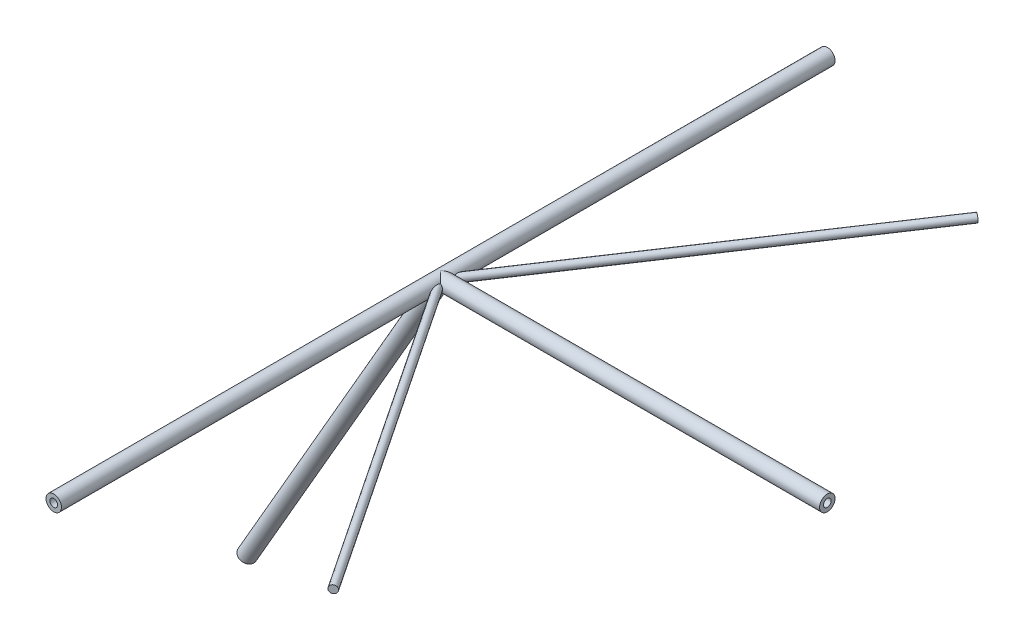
SolidWorks part; units mm, degrees
ref_plane "Front Plane" through (0, 0, 0) normal (0, 0, 1) x (1, 0, 0)
ref_plane "Top Plane" through (0, 0, 0) normal (0, 1, 0) x (1, 0, 0)
ref_plane "Right Plane" through (0, 0, 0) normal (1, 0, 0) x (0, 0, -1)
sketch "Sketch3" plane through (0, 0, 0) normal (0, 1, 0) x (1, 0, 0)
  line L0 (0, 0) -> (500, 0)
  dimension "D1" = 500
sketch "Sketch5" plane through (0, 0, 0) normal (0, 0, 1) x (1, 0, 0)
  line L0 (0, 0) -> (-250, -433.0127)
  line L1 (0, 0) -> (500, 0) construction
  dimension "D1" = 120
  dimension "D2" = 500
sketch "Sketch6" plane through (0, 0, 0) normal (1, 0, 0) x (0, 0, -1)
  line L0 (500, 0) -> (-500, 0)
  dimension "D1" = 1000
ref_plane "Plane1" through (0, 0, 500) normal (0, 0, 1) x (1, 0, 0)
ref_plane "Plane2" through (500, 0, 0) normal (1, 0, 0) x (0, 0, -1)
ref_plane "Plane3" through (0, 0, 0) normal (-0.866, 0.5, 0) x (0, 0, 1)
ref_plane "Plane4" through (-250, -433.0127, 0) normal (-0.5, -0.866, 0) x (-0.866, 0.5, 0)
sketch "Sketch7" plane through (0, 0, 500) normal (0, 0, 1) x (1, 0, 0)
  circle A0 centre (0, 0) radius 10
  dimension "D1" = 20
sketch "Sketch8" plane through (500, 0, 0) normal (1, 0, 0) x (0, 0, -1)
  circle A0 centre (0, 0) radius 10
  dimension "D1" = 20
sketch "Sketch9" plane through (-250, -433.0127, 0) normal (-0.5, -0.866, 0) x (-0.866, 0.5, 0)
  circle A0 centre (0, 0) radius 10
  dimension "D1" = 20
sweep "Sweep1" add profiles "Sketch7" path "Sketch6"
sweep "Sweep2" add profiles "Sketch9" path "Sketch5"
sweep "Sweep3" add profiles "Sketch8" path "Sketch3"
sketch "Sketch10" plane through (0, 0, 0) normal (0, 1, 0) x (1, 0, 0)
  line L1 (0, 0) -> (277.3496, -416.0255)
  line L3 (0, 0) -> (0, -20.4267) construction
  dimension "D2" = 33.69
  dimension "D4" = 500
sketch "Sketch11" plane through (0, 0, 0) normal (0, 1, 0) x (1, 0, 0)
  line L0 (0, 0) -> (277.3496, 416.0255)
  line L1 (0, 0) -> (0, 60.2968) construction
  dimension "D1" = 33.69
  dimension "D2" = 500
ref_plane "Plane5" through (277.3496, 0, -416.0255) normal (0.5547, 0, -0.8321) x (-0.8321, 0, -0.5547)
ref_plane "Plane6" through (277.3496, 0, 416.0255) normal (0.5547, 0, 0.8321) x (0.8321, 0, -0.5547)
sketch "Sketch12" plane through (277.3496, 0, -416.0255) normal (0.5547, 0, -0.8321) x (-0.8321, 0, -0.5547)
  circle A0 centre (0, 0) radius 5
  dimension "D1" = 10
sketch "Sketch13" plane through (277.3496, 0, 416.0255) normal (0.5547, 0, 0.8321) x (0.8321, 0, -0.5547)
  circle A0 centre (0, 0) radius 5
  dimension "D1" = 10
sweep "Sweep4" add profiles "Sketch13" path "Sketch10"
sweep "Sweep5" add profiles "Sketch12" path "Sketch11"
shell "Shell1" thickness 5
